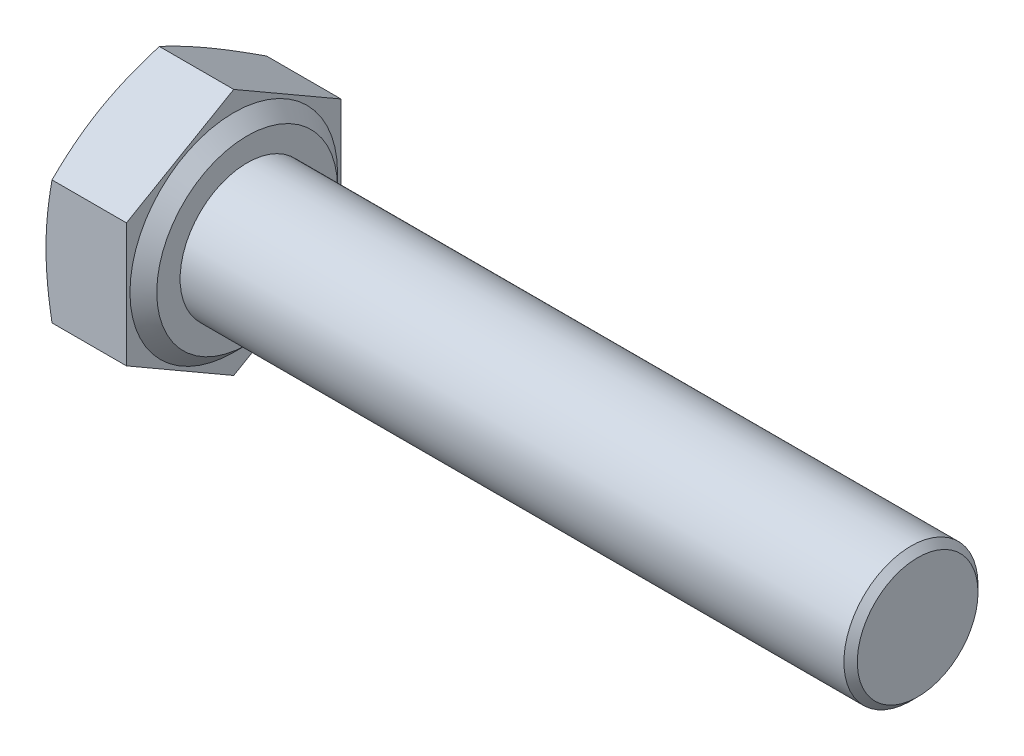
SolidWorks part; units mm, degrees
ref_plane "Front" through (0, 0, 0) normal (0, 0, 1) x (1, 0, 0)
ref_plane "Top" through (0, 0, 0) normal (0, 1, 0) x (1, 0, 0)
ref_plane "Right" through (0, 0, 0) normal (1, 0, 0) x (0, 0, -1)
sketch "Sketch2" plane through (0, 0, 0) normal (1, 0, 0) x (0, 0, -1)
  line L1 (0, -4.6188) -> (4, -2.3094)
  line L2 (4, -2.3094) -> (4, 2.3094)
  line L3 (4, 2.3094) -> (0, 4.6188)
  line L4 (0, 4.6188) -> (-4, 2.3094)
  line L5 (-4, 2.3094) -> (-4, -2.3094)
  line L6 (-4, -2.3094) -> (0, -4.6188)
  circle A0 centre (0, 0) radius 4 construction
  dimension "s" = 8
extrude "BaseHead" add sketch "Sketch2" along normal blind 3.5
sketch "Sketch3" plane through (0, 0, 0) normal (0, 0, 1) x (1, 0, 0)
  line L0 (3.5, 4.6188) -> (3.5, 3.37)
  line L2 (3.5, 3.37) -> (3, 3.87)
  line L3 (3, 3.87) -> (3, 4.6188)
  line L5 (3, 4.6188) -> (3.5, 4.6188)
  line L6 (-0.9571, 0) -> (7.6478, 0) construction
  line L7 (3.5, 4.6188) -> (0, 4.6188) construction
  dimension "D1" = 45
  dimension "c" = 0.5
  dimension "dw" = 6.74
revolve "BearingFace" cut sketch "Sketch3" angle 360 about L6
sketch "Sketch4" plane through (0, 0, 0) normal (0, 0, 1) x (1, 0, 0)
  line L0 (-0.4935, 0) -> (3.5626, 0) construction
  line L2 (0, 4.6188) -> (0.2252, 4.6188)
  line L4 (0.2252, 4.6188) -> (0, 4)
  line L6 (0, 4) -> (0, 4.6188)
  line L7 (3, 4.6188) -> (0, 4.6188) construction
  dimension "D1" = 20
  dimension "D2" = 8
revolve "HeadChamfer" cut sketch "Sketch4" angle 360 about L0
ref_plane "Plane1" through (12.5, 0, 0) normal (1, 0, 0) x (0, 0, -1)
sketch "Sketch5" plane through (3.5, 0, 0) normal (1, 0, 0) x (0, 0, -1)
  circle A0 centre (0, 0) radius 2.5
  dimension "d" = 5
extrude "BaseBody" add sketch "Sketch5" along normal blind 25
chamfer "Chamfer1" distance 0.25 angle 45 1 edges at (28.5, 0, -2.5)
fillet "HeadFillet" [suppressed] radius 0.2
sketch "Sketch6" plane through (0, 0, 0) normal (0, 0, 1) x (1, 0, 0)
  line L0 (27.817, 2.933) -> (28.25, 2.933)
  line L1 (28.25, 2.933) -> (28.25, 2.5)
  line L2 (28.25, 2.5) -> (28.0335, 2.125)
  line L3 (28.0335, 2.125) -> (27.817, 2.5)
  line L4 (27.817, 2.5) -> (27.817, 2.933)
  line L5 (28.25, -2.5) -> (28.25, 2.5) construction
  line L6 (28.25, 2.5) -> (3.5, 2.5) construction
  dimension "D1" = 0.433
revolve "Cut-Revolve10" [suppressed] cut sketch "Sketch6" angle 360
pattern_linear "LPattern10" [suppressed] count 31
equation "\"D2@Sketch4\" = \"s@Sketch2\""
equation "\"D1@Chamfer1\" = 0.05 * \"d@Sketch5\""
equation "\"D1@ThreadCosmetic1\" = \"l@BaseBody\" - \"lg@Plane1\""
equation "\"D1@Sketch6\" =  ( \"d@Sketch5\" - \"D2@ThreadCosmetic1\" )  / 2"
equation "\"pitch@LPattern10\" = 1.2 * \"D1@Sketch6\""
equation "\"D1@LPattern10\" = \"D1@ThreadCosmetic1\" / \"pitch@LPattern10\""
